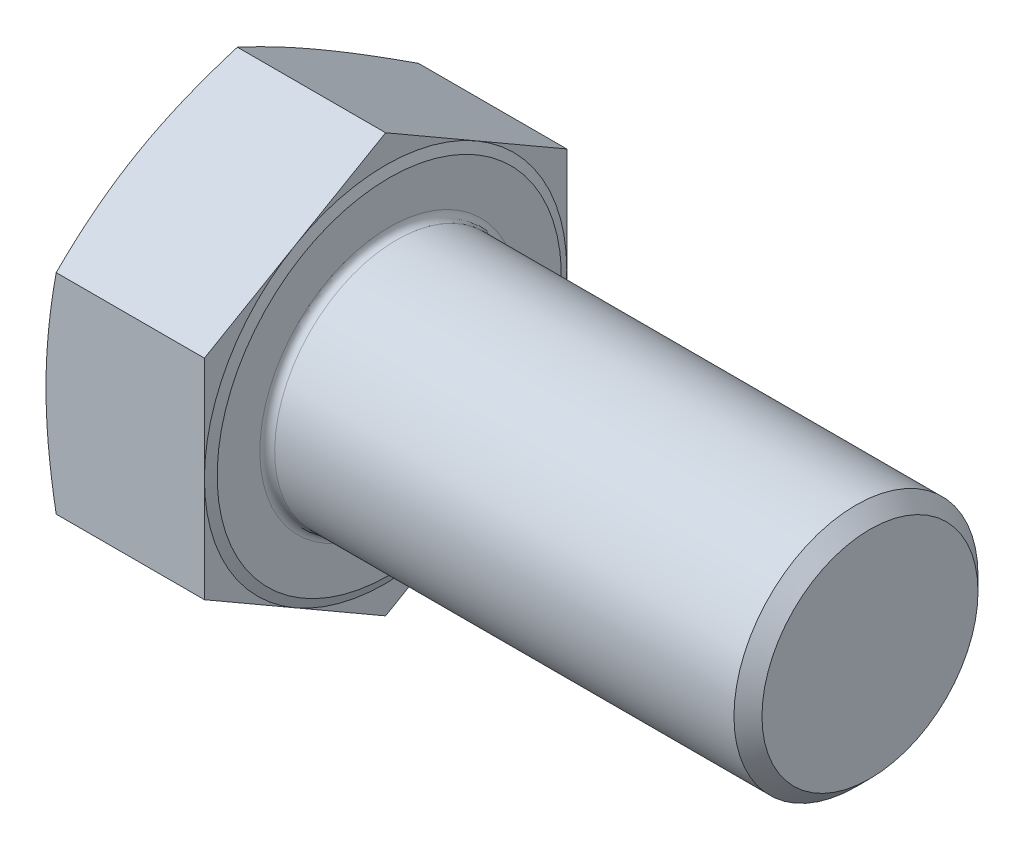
SolidWorks part; units mm, degrees
ref_plane "Front" through (0, 0, 0) normal (0, 0, 1) x (1, 0, 0)
ref_plane "Top" through (0, 0, 0) normal (0, 1, 0) x (1, 0, 0)
ref_plane "Right" through (0, 0, 0) normal (1, 0, 0) x (0, 0, -1)
sketch "Sketch-BaseHead" plane through (0, 0, 0) normal (1, 0, 0) x (0, 0, -1)
  line L1 (0, -28.2902) -> (24.5, -14.1451)
  line L2 (24.5, -14.1451) -> (24.5, 14.1451)
  line L3 (24.5, 14.1451) -> (0, 28.2902)
  line L4 (0, 28.2902) -> (-24.5, 14.1451)
  line L5 (-24.5, 14.1451) -> (-24.5, -14.1451)
  line L6 (-24.5, -14.1451) -> (0, -28.2902)
  circle A0 centre (0, 0) radius 24.5 construction
  dimension "s" = 49
extrude "BaseHead" add sketch "Sketch-BaseHead" along normal blind 21.42
sketch "Sketch4" plane through (-0.2646, -5.9169, 0) normal (0, 0, 1) x (0, 1, 0)
  line L0 (5.9169, 3.7369) -> (5.9169, -10.4477) construction
  line L2 (34.2071, -0.2646) -> (30.4169, -0.2646)
  line L4 (30.4169, -0.2646) -> (34.2071, -1.6441)
  line L6 (34.2071, -1.6441) -> (34.2071, -0.2646)
  dimension "D1" = 20
  dimension "D2" = 49
revolve "HeadChamfer" cut sketch "Sketch4" angle 360 about L0
sketch "Sketch1" plane through (0, 0, 0) normal (0, 1, 0) x (1, 0, 0)
  line L0 (21.42, 0) -> (21.92, 0)
  line L1 (21.92, 0) -> (21.92, 23.275)
  line L2 (21.92, 23.275) -> (21.42, 24.5)
  line L3 (21.42, 24.5) -> (21.42, 0)
  line L4 (-4.0016, 0) -> (10.1831, 0) construction
  dimension "D1" = 24.5
  dimension "D2" = 23.275
  dimension "D3" = 0.5
revolve "Revolve1" add sketch "Sketch1" angle 360 about axis through (-4.0016, 0, 0) along (1, 0, 0)
sketch "Sketch3" plane through (21.92, 0, 0) normal (1, 0, 0) x (0, 0, -1)
  circle A0 centre (0, 0) radius 16.5
  dimension "d" = 33
extrude "BaseBody" add sketch "Sketch3" along normal blind 65
chamfer "Chamfer1" distance 1.8945 angle 45 1 edges at (86.92, 16.5, 0)
fillet "HeadFillet" radius 1 1 edges at (21.92, -16.5, 0)
equation "\"D1@Sketch1\" = \"s@Sketch-BaseHead\" / 2 "
equation "\"D2@Sketch4\" = \"s@Sketch-BaseHead\""
equation "\"D1@Chamfer1\" =  ( \"d@Sketch3\" - \"D2@ThreadCosmetic1\" ) / 2 "
